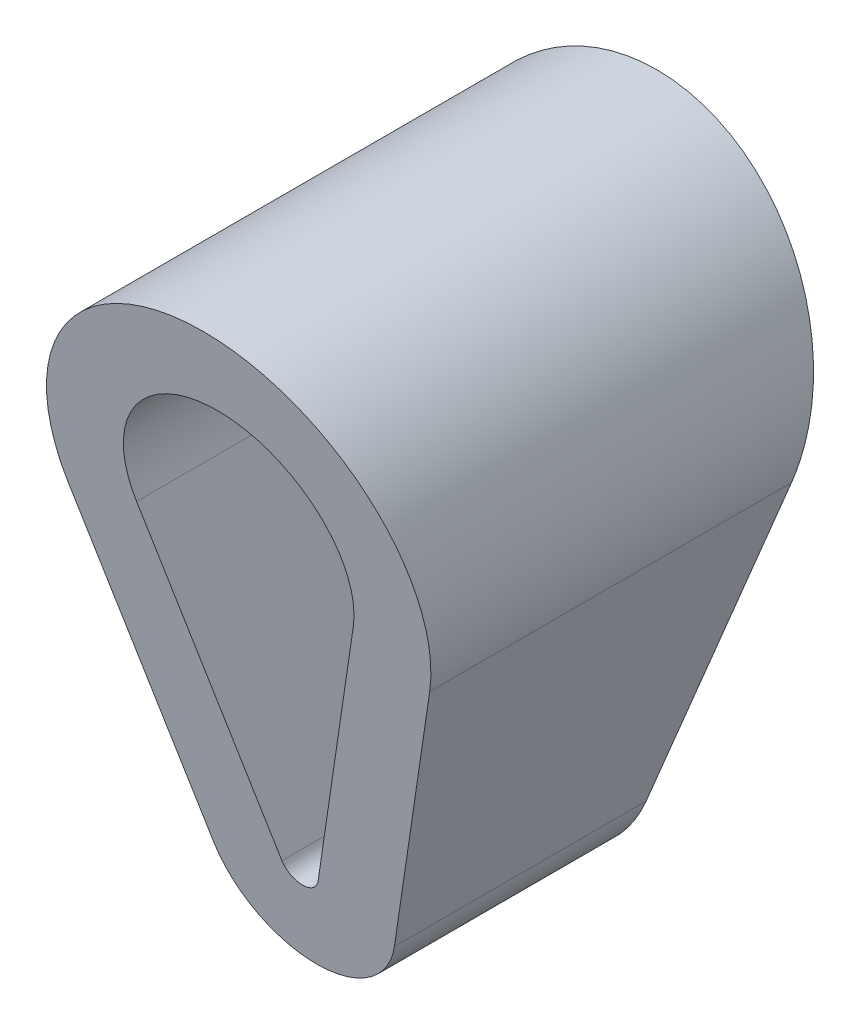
SolidWorks part; units mm, degrees
ref_plane "Plan de face" through (0, 0, 0) normal (0, 0, 1) x (1, 0, 0)
ref_plane "Plan de dessus" through (0, 0, 0) normal (0, 1, 0) x (1, 0, 0)
ref_plane "Plan de droite" through (0, 0, 0) normal (1, 0, 0) x (0, 0, -1)
sketch "Esquisse1" plane through (0, 0, 0) normal (0, 0, 1) x (1, 0, 0)
  line L0 (0, 6.75) -> (0, -1.25) construction
  line L1 (2.3894, 3.5147) -> (1.1947, -0.3676)
  line L2 (-2.3894, 3.5147) -> (-1.1947, -0.3676)
  line L3 (1.4337, 3.8088) -> (0.2389, -0.0735)
  line L4 (-1.4337, 3.8088) -> (-0.2389, -0.0735)
  arc A0 (-1.1947, -0.3676) -> (1.1947, -0.3676) centre (0, 0) ccw
  arc A1 (2.3894, 3.5147) -> (-2.3894, 3.5147) centre (0, 4.25) ccw
  arc A2 (-0.2389, -0.0735) -> (0.2389, -0.0735) centre (0, 0) ccw
  arc A3 (1.4337, 3.8088) -> (-1.4337, 3.8088) centre (0, 4.25) ccw
  point P5 (0, -1.25)
  point P6 (0, 6.75)
  dimension "D2" = 5
  dimension "D3" = 2.5
  dimension "D1" = 8
  dimension "D4" = 1
extrude "Boss.-Extru.1" add sketch "Esquisse1" along normal mid plane 6
sketch "Esquisse2" plane through (0, 0, 0) normal (1, 0, 0) x (0, 0, -1)
  line L0 (-3, 6.75) -> (-1.5, -1.25)
  line L1 (-3, -1.25) -> (3, -1.25) construction
  line L2 (-1.5, -1.25) -> (-3, -1.25)
  line L3 (-3, -1.25) -> (-3, 6.75)
  line L4 (3, 6.75) -> (3, -1.25)
  line L5 (3, -1.25) -> (1.5, -1.25)
  line L6 (1.5, -1.25) -> (3, 6.75)
  dimension "D1" = 3
  dimension "D2" = 1.5
extrude "Enlèv. mat.-Extru.1" cut sketch "Esquisse2" along normal through all both and the other way through all
